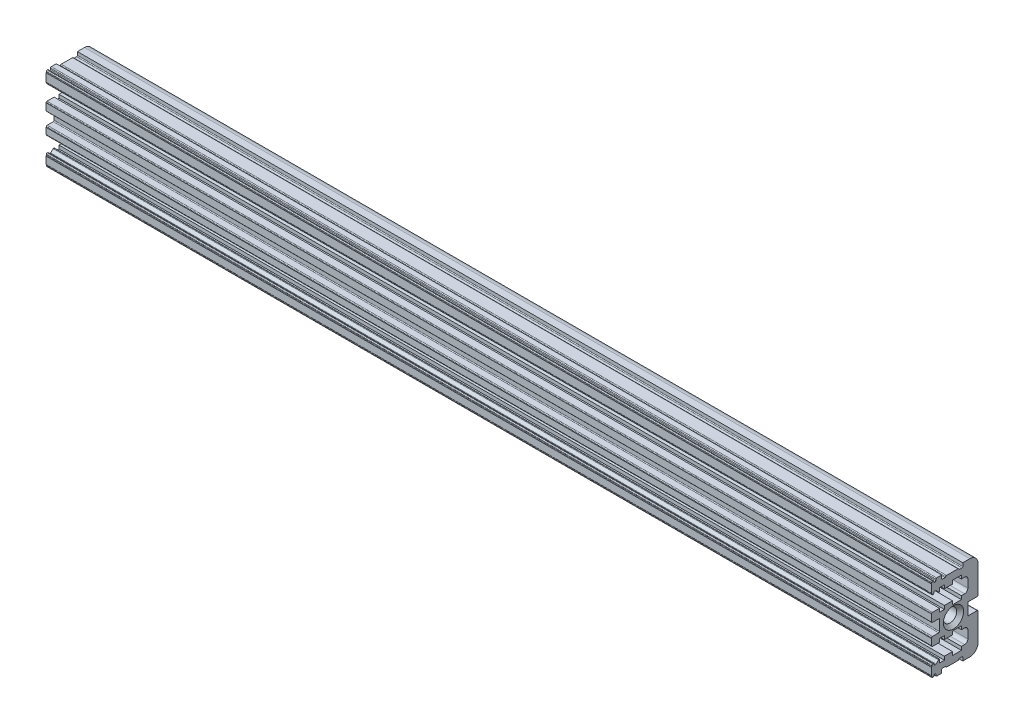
SolidWorks part; units mm, degrees
other "1"
ref_plane "前视基准面" through (0, 0, 0) normal (0, 0, 1) x (1, 0, 0)
ref_plane "上视基准面" through (0, 0, 0) normal (0, 1, 0) x (1, 0, 0)
ref_plane "右视基准面" through (0, 0, 0) normal (1, 0, 0) x (0, 0, -1)
imported_body "输入1"
sketch "草图1" plane through (0, 0, 8.75) normal (0, 0, -1) x (-1, 0, 0)
  line L0 (-215.9, -1.4) -> (-215.9, -8.2) construction
  line L1 (215.9, -37.1242) -> (2.54, -37.1242)
  line L2 (215.9, -37.1242) -> (215.9, 45.6551)
  line L3 (215.9, 45.6551) -> (2.54, 45.6551)
  line L4 (2.54, -37.1242) -> (2.54, 45.6551)
  line L5 (215.9, -1.4) -> (215.9, -8.2) construction
  point P4 (-215.9, -4.8)
  dimension "D1" = 218.44
extrude "切除-拉伸1" cut sketch "草图1" against normal through all
sketch "草图2" plane through (-2.54, 0, 0) normal (-1, 0, 0) x (0, 0, 1)
  circle A0 centre (14.8, -9.9) radius 1.65
extrude "切除-拉伸2" cut sketch "草图2" against normal blind 15.02
chamfer "倒角1" distance 0.85 angle 45 1 edges at (-2.54, -9.9, 16.45)
